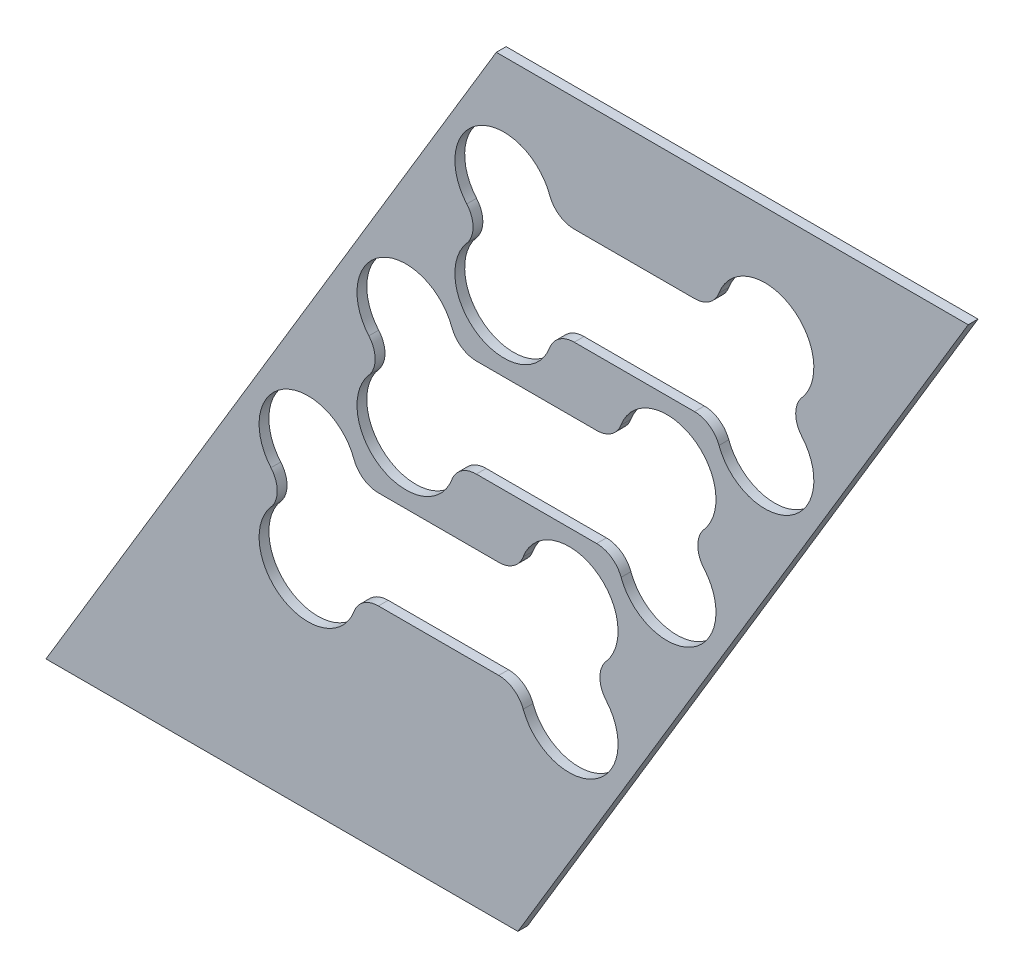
SolidWorks part; units mm, degrees
ref_plane "XY" through (0, 0, 0) normal (0, 0, 1) x (1, 0, 0)
ref_plane "XZ" through (0, 0, 0) normal (0, 1, 0) x (1, 0, 0)
ref_plane "YZ" through (0, 0, 0) normal (1, 0, 0) x (0, 0, -1)
sketch "Esquisse1" plane through (0, 0, 0) normal (0, 0, 1) x (1, 0, 0)
  line L0 (8.8481, 75) -> (-60.1519, -40)
  line L1 (8.8481, 75) -> (81.1519, 75)
  line L2 (81.1519, 75) -> (12.1519, -40)
  line L3 (-60.1519, -40) -> (12.1519, -40)
  line L4 (39.2181, 57.5) -> (20.7819, 57.5) construction
  line L5 (52.8589, 62.2648) -> (20.0767, 7.6278) construction
  dimension "D1" = 31
  dimension "D2" = 62
  dimension "D3" = 75
  dimension "D4" = 115
extrude "Feuillard" add sketch "Esquisse1" along normal blind 1.5
sketch "Esquisse2" plane through (0, 0, 0) normal (0, 0, 1) x (1, 0, 0)
  line L2 (9.2181, 7.5) -> (-9.2181, 7.5)
  line L3 (-9.2181, -7.5) -> (9.2181, -7.5)
  line L4 (9.2181, 7.5) -> (-9.2181, 7.5)
  line L5 (-9.2181, -7.5) -> (9.2181, -7.5)
  line L6 (24.2181, 32.5) -> (5.7819, 32.5)
  line L7 (5.7819, 17.5) -> (24.2181, 17.5)
  line L8 (24.2181, 32.5) -> (5.7819, 32.5)
  line L9 (5.7819, 17.5) -> (24.2181, 17.5)
  line L10 (39.2181, 57.5) -> (20.7819, 57.5)
  line L11 (20.7819, 42.5) -> (39.2181, 42.5)
  line L12 (39.2181, 57.5) -> (20.7819, 57.5)
  line L13 (20.7819, 42.5) -> (39.2181, 42.5)
  arc A10 (-12.9683, 10.1087) -> (-9.2181, 7.5) centre (-9.2181, 11.5) ccw
  arc A11 (-12.9683, 10.1087) -> (-25.6855, 2.6087) centre (-20, 7.5) ccw
  arc A12 (-25.6855, -2.6087) -> (-25.6855, 2.6087) centre (-28.7178, 0) ccw
  arc A13 (-25.6855, -2.6087) -> (-12.9683, -10.1087) centre (-20, -7.5) ccw
  arc A14 (-9.2181, -7.5) -> (-12.9683, -10.1087) centre (-9.2181, -11.5) ccw
  arc A15 (12.9683, -10.1087) -> (9.2181, -7.5) centre (9.2181, -11.5) ccw
  arc A16 (12.9683, -10.1087) -> (25.6855, -2.6087) centre (20, -7.5) ccw
  arc A17 (25.6855, 2.6087) -> (25.6855, -2.6087) centre (28.7178, 0) ccw
  arc A18 (25.6855, 2.6087) -> (12.9683, 10.1087) centre (20, 7.5) ccw
  arc A19 (9.2181, 7.5) -> (12.9683, 10.1087) centre (9.2181, 11.5) ccw
  arc A20 (-12.9683, 10.1087) -> (-9.2181, 7.5) centre (-9.2181, 11.5) ccw
  arc A21 (-12.9683, 10.1087) -> (-25.6855, 2.6087) centre (-20, 7.5) ccw
  arc A22 (-25.6855, -2.6087) -> (-25.6855, 2.6087) centre (-28.7178, 0) ccw
  arc A23 (-25.6855, -2.6087) -> (-12.9683, -10.1087) centre (-20, -7.5) ccw
  arc A24 (-9.2181, -7.5) -> (-12.9683, -10.1087) centre (-9.2181, -11.5) ccw
  arc A25 (12.9683, -10.1087) -> (9.2181, -7.5) centre (9.2181, -11.5) ccw
  arc A26 (12.9683, -10.1087) -> (25.6855, -2.6087) centre (20, -7.5) ccw
  arc A27 (25.6855, 2.6087) -> (25.6855, -2.6087) centre (28.7178, 0) ccw
  arc A28 (25.6855, 2.6087) -> (12.9683, 10.1087) centre (20, 7.5) ccw
  arc A29 (9.2181, 7.5) -> (12.9683, 10.1087) centre (9.2181, 11.5) ccw
  arc A30 (2.0317, 35.1087) -> (5.7819, 32.5) centre (5.7819, 36.5) ccw
  arc A31 (2.0317, 35.1087) -> (-10.6855, 27.6087) centre (-5, 32.5) ccw
  arc A32 (-10.6855, 22.3913) -> (-10.6855, 27.6087) centre (-13.7178, 25) ccw
  arc A33 (-10.6855, 22.3913) -> (2.0317, 14.8913) centre (-5, 17.5) ccw
  arc A34 (5.7819, 17.5) -> (2.0317, 14.8913) centre (5.7819, 13.5) ccw
  arc A35 (27.9683, 14.8913) -> (24.2181, 17.5) centre (24.2181, 13.5) ccw
  arc A36 (27.9683, 14.8913) -> (40.6855, 22.3913) centre (35, 17.5) ccw
  arc A37 (40.6855, 27.6087) -> (40.6855, 22.3913) centre (43.7178, 25) ccw
  arc A38 (40.6855, 27.6087) -> (27.9683, 35.1087) centre (35, 32.5) ccw
  arc A39 (24.2181, 32.5) -> (27.9683, 35.1087) centre (24.2181, 36.5) ccw
  arc A40 (2.0317, 35.1087) -> (5.7819, 32.5) centre (5.7819, 36.5) ccw
  arc A41 (2.0317, 35.1087) -> (-10.6855, 27.6087) centre (-5, 32.5) ccw
  arc A42 (-10.6855, 22.3913) -> (-10.6855, 27.6087) centre (-13.7178, 25) ccw
  arc A43 (-10.6855, 22.3913) -> (2.0317, 14.8913) centre (-5, 17.5) ccw
  arc A44 (5.7819, 17.5) -> (2.0317, 14.8913) centre (5.7819, 13.5) ccw
  arc A45 (27.9683, 14.8913) -> (24.2181, 17.5) centre (24.2181, 13.5) ccw
  arc A46 (27.9683, 14.8913) -> (40.6855, 22.3913) centre (35, 17.5) ccw
  arc A47 (40.6855, 27.6087) -> (40.6855, 22.3913) centre (43.7178, 25) ccw
  arc A48 (40.6855, 27.6087) -> (27.9683, 35.1087) centre (35, 32.5) ccw
  arc A49 (24.2181, 32.5) -> (27.9683, 35.1087) centre (24.2181, 36.5) ccw
  arc A50 (17.0317, 60.1087) -> (20.7819, 57.5) centre (20.7819, 61.5) ccw
  arc A51 (17.0317, 60.1087) -> (4.3145, 52.6087) centre (10, 57.5) ccw
  arc A52 (4.3145, 47.3913) -> (4.3145, 52.6087) centre (1.2822, 50) ccw
  arc A53 (4.3145, 47.3913) -> (17.0317, 39.8913) centre (10, 42.5) ccw
  arc A54 (20.7819, 42.5) -> (17.0317, 39.8913) centre (20.7819, 38.5) ccw
  arc A55 (42.9683, 39.8913) -> (39.2181, 42.5) centre (39.2181, 38.5) ccw
  arc A56 (42.9683, 39.8913) -> (55.6855, 47.3913) centre (50, 42.5) ccw
  arc A57 (55.6855, 52.6087) -> (55.6855, 47.3913) centre (58.7178, 50) ccw
  arc A58 (55.6855, 52.6087) -> (42.9683, 60.1087) centre (50, 57.5) ccw
  arc A59 (39.2181, 57.5) -> (42.9683, 60.1087) centre (39.2181, 61.5) ccw
  arc A60 (17.0317, 60.1087) -> (20.7819, 57.5) centre (20.7819, 61.5) ccw
  arc A61 (17.0317, 60.1087) -> (4.3145, 52.6087) centre (10, 57.5) ccw
  arc A62 (4.3145, 47.3913) -> (4.3145, 52.6087) centre (1.2822, 50) ccw
  arc A63 (4.3145, 47.3913) -> (17.0317, 39.8913) centre (10, 42.5) ccw
  arc A64 (20.7819, 42.5) -> (17.0317, 39.8913) centre (20.7819, 38.5) ccw
  arc A65 (42.9683, 39.8913) -> (39.2181, 42.5) centre (39.2181, 38.5) ccw
  arc A66 (42.9683, 39.8913) -> (55.6855, 47.3913) centre (50, 42.5) ccw
  arc A67 (55.6855, 52.6087) -> (55.6855, 47.3913) centre (58.7178, 50) ccw
  arc A68 (55.6855, 52.6087) -> (42.9683, 60.1087) centre (50, 57.5) ccw
  arc A69 (39.2181, 57.5) -> (42.9683, 60.1087) centre (39.2181, 61.5) ccw
  dimension "D1" = 0
  dimension "D2" = 0
  dimension "D3" = 0
extrude "Découpe" cut sketch "Esquisse2" along normal through all
